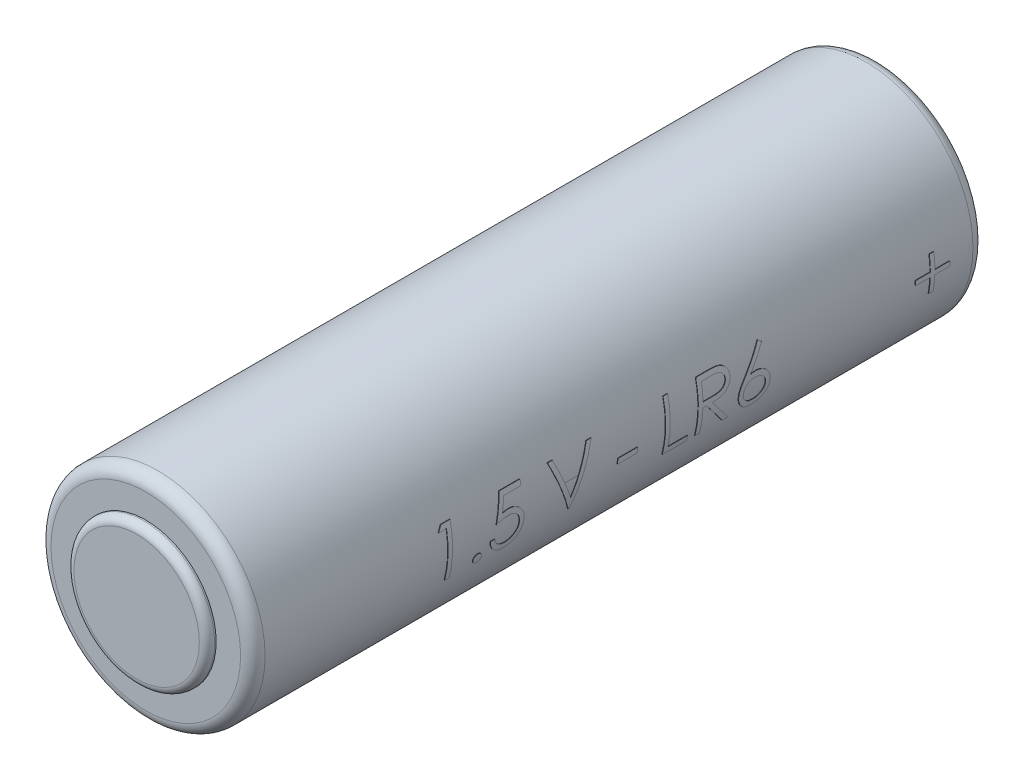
SolidWorks part; units mm, degrees
ref_plane "Face" through (0, 0, 0) normal (0, 0, 1) x (1, 0, 0)
ref_plane "Dessus" through (0, 0, 0) normal (0, 1, 0) x (1, 0, 0)
ref_plane "Droite" through (0, 0, 0) normal (1, 0, 0) x (0, 0, -1)
sketch "Esquisse1" plane through (0, 0, 0) normal (0, 0, 1) x (1, 0, 0)
  circle A0 centre (0, 0) radius 7
extrude "Base-Extrusion" add sketch "Esquisse1" along normal blind 47.9
sketch "Esquisse2" plane through (0, 0, 47.9) normal (0, 0, 1) x (1, 0, 0)
  circle A0 centre (0, 0) radius 4.6
extrude "Boss.-Extru.1" add sketch "Esquisse2" along normal blind 0.6
sketch "Esquisse3" plane through (0, 0, 0) normal (0, 0, -1) x (-1, 0, 0)
  circle A0 centre (0, 0) radius 5.5
extrude "Enlèv. mat.-Extru.1" cut sketch "Esquisse3" against normal blind 0.3
sketch "Esquisse4" plane through (0, 0, 0.3) normal (0, 0, -1) x (-1, 0, 0)
  circle A0 centre (0, 0) radius 2.7
extrude "Boss.-Extru.2" add sketch "Esquisse4" along normal blind 1.7
fillet "Congé1" radius 0.5
fillet "Congé2" radius 0.5
fillet "Congé3" radius 0.5
fillet "Congé4" radius 0.8
sketch "Esquisse5" plane through (0, 0, 0) normal (1, 0, 0) x (0, 0, -1)
  text T0 "1.5 V - LR6       +"
extrude "Boss.-Extru.3" add sketch "Esquisse5" along normal blind 11.7
sketch "Esquisse6" plane through (0, 0, -1.4) normal (0, 0, -1) x (-1, 0, 0)
  circle A0 centre (0, 0) radius 7.03
extrude "Enlèv. mat.-Extru.3" cut sketch "Esquisse6" against normal through all flip side to cut
